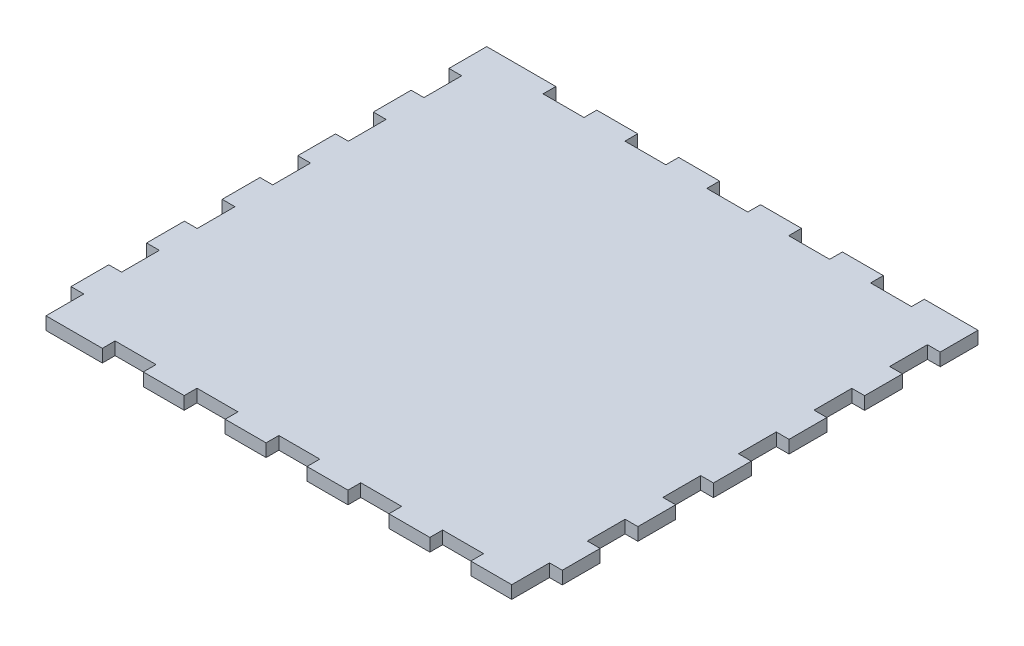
SolidWorks part; units mm, degrees
ref_plane "Front Plane" through (0, 0, 0) normal (0, 0, 1) x (1, 0, 0)
ref_plane "Top Plane" through (0, 0, 0) normal (0, 1, 0) x (1, 0, 0)
ref_plane "Right Plane" through (0, 0, 0) normal (1, 0, 0) x (0, 0, -1)
sketch "Sketch1" plane through (0, 0, 0) normal (0, 1, 0) x (1, 0, 0)
  line L1 (-65, 60) -> (65, 60)
  line L2 (-65, 60) -> (-65, -60)
  line L3 (-65, -60) -> (65, -60)
  line L4 (65, 60) -> (65, -60)
  line L5 (-65, 60) -> (65, -60) construction
  line L6 (-65, -60) -> (65, 60) construction
  point P0 (0, 0)
  dimension "D1" = 120
  dimension "D2" = 130
extrude "Boss-Extrude1" add sketch "Sketch1" along normal blind 3.38
sketch "Sketch4" plane through (0, 3.38, 0) normal (0, 1, 0) x (1, 0, 0)
  line L0 (-65, 60) -> (-65, 50)
  line L1 (-65, 60) -> (-65, -60) construction
  line L2 (-65, 50) -> (-61.62, 50)
  line L3 (-61.62, 50) -> (-61.62, 40)
  line L4 (-61.62, 40) -> (-65, 40)
  line L5 (-65, 40) -> (-65, 30)
  line L6 (-65, 30) -> (-61.62, 30)
  line L7 (-61.62, 30) -> (-61.62, 20)
  line L8 (-61.62, 20) -> (-65, 20)
  line L9 (-65, 20) -> (-65, 10)
  line L10 (-65, 10) -> (-61.62, 10)
  line L11 (-61.62, 10) -> (-61.62, 0)
  line L12 (-61.62, 0) -> (-65, 0)
  line L13 (-65, 0) -> (-65, -10)
  line L14 (-65, -10) -> (-61.62, -10)
  line L15 (-61.62, -10) -> (-61.62, -20)
  line L16 (-61.62, -20) -> (-65, -20)
  line L17 (-65, -20) -> (-65, -30)
  line L18 (-65, -30) -> (-61.62, -30)
  line L19 (-61.62, -30) -> (-61.62, -40)
  line L20 (-61.62, -40) -> (-65, -40)
  line L21 (-65, -40) -> (-65, -50)
  line L22 (-65, -50) -> (-61.62, -50)
  line L23 (-61.62, -50) -> (-61.62, -60)
  line L24 (-65, -60) -> (65, -60) construction
  line L25 (0, 60) -> (0, -60) construction
  line L26 (65, 60) -> (-65, 60) construction
  line L27 (61.62, -50) -> (61.62, -60)
  line L28 (65, -50) -> (61.62, -50)
  line L29 (65, -40) -> (65, -50)
  line L30 (61.62, -40) -> (65, -40)
  line L31 (61.62, -30) -> (61.62, -40)
  line L32 (65, -30) -> (61.62, -30)
  line L33 (65, -20) -> (65, -30)
  line L34 (61.62, -20) -> (65, -20)
  line L35 (61.62, -10) -> (61.62, -20)
  line L36 (65, -10) -> (61.62, -10)
  line L37 (65, 0) -> (65, -10)
  line L38 (61.62, 0) -> (65, 0)
  line L39 (61.62, 10) -> (61.62, 0)
  line L40 (65, 10) -> (61.62, 10)
  line L41 (65, 20) -> (65, 10)
  line L42 (61.62, 20) -> (65, 20)
  line L43 (61.62, 30) -> (61.62, 20)
  line L44 (65, 30) -> (61.62, 30)
  line L45 (65, 40) -> (65, 30)
  line L46 (61.62, 40) -> (65, 40)
  line L47 (61.62, 50) -> (61.62, 40)
  line L48 (65, 50) -> (61.62, 50)
  line L49 (65, 60) -> (65, 50)
  line L50 (-65, 60) -> (-65, -60)
  line L51 (-65, -60) -> (-61.62, -60)
  line L52 (65, 60) -> (65, -60)
  line L53 (65, -60) -> (61.62, -60)
extrude "Cut-Extrude2" cut sketch "Sketch4" against normal blind 3.38 contours L44 L43 L42 M5 | L48 L47 L46 M5 | L40 L39 L38 M5 | L36 L35 L34 M5 | L28 L27 M5 M8 | L32 L31 L30 M5 | L23 L22 M7 M8 | L20 L19 L18 M7 | L16 L15 L14 M7 | L12 L11 L10 M7 | L8 L7 L6 M7 | L4 L3 L2 M7
sketch "Sketch5" plane through (0, 3.38, 0) normal (0, 1, 0) x (1, 0, 0)
  line L0 (61.62, 0) -> (-61.62, 0) construction
  line L2 (50.7867, 60) -> (61.62, 60)
  line L3 (-61.62, -60) -> (61.62, -60) construction
  line L4 (50.7867, 56.62) -> (50.7867, 60)
  line L5 (-46.7133, -60) -> (-46.7133, -56.62)
  line L6 (-46.7133, -56.62) -> (-35.88, -56.62)
  line L7 (-35.88, -56.62) -> (-35.88, -60)
  line L8 (-35.88, -60) -> (-25.0467, -60)
  line L9 (-25.0467, -60) -> (-25.0467, -56.62)
  line L10 (-25.0467, -56.62) -> (-14.2133, -56.62)
  line L11 (-14.2133, -56.62) -> (-14.2133, -60)
  line L12 (-14.2133, -60) -> (-3.38, -60)
  line L13 (-3.38, -60) -> (-3.38, -56.62)
  line L14 (-3.38, -56.62) -> (7.4533, -56.62)
  line L15 (7.4533, -56.62) -> (7.4533, -60)
  line L16 (7.4533, -60) -> (18.2867, -60)
  line L17 (18.2867, -60) -> (18.2867, -56.62)
  line L18 (18.2867, -56.62) -> (29.12, -56.62)
  line L19 (29.12, -56.62) -> (29.12, -60)
  line L20 (29.12, -60) -> (39.9533, -60)
  line L21 (39.9533, -60) -> (39.9533, -56.62)
  line L22 (39.9533, -56.62) -> (50.7867, -56.62)
  line L23 (50.7867, -56.62) -> (50.7867, -60)
  line L24 (50.7867, -60) -> (61.62, -60)
  line L25 (39.9533, 56.62) -> (50.7867, 56.62)
  line L26 (39.9533, 60) -> (39.9533, 56.62)
  line L27 (29.12, 60) -> (39.9533, 60)
  line L28 (29.12, 56.62) -> (29.12, 60)
  line L29 (18.2867, 56.62) -> (29.12, 56.62)
  line L30 (18.2867, 60) -> (18.2867, 56.62)
  line L31 (7.4533, 60) -> (18.2867, 60)
  line L32 (7.4533, 56.62) -> (7.4533, 60)
  line L33 (-3.38, 56.62) -> (7.4533, 56.62)
  line L34 (-3.38, 60) -> (-3.38, 56.62)
  line L35 (-14.2133, 60) -> (-3.38, 60)
  line L36 (-14.2133, 56.62) -> (-14.2133, 60)
  line L37 (-25.0467, 56.62) -> (-14.2133, 56.62)
  line L38 (-25.0467, 60) -> (-25.0467, 56.62)
  line L39 (-35.88, 60) -> (-25.0467, 60)
  line L40 (-35.88, 56.62) -> (-35.88, 60)
  line L41 (-46.7133, 56.62) -> (-35.88, 56.62)
  line L42 (-46.7133, 60) -> (-46.7133, 56.62)
  line L43 (-46.7133, -60) -> (50.7867, -60)
  line L44 (-46.7133, 60) -> (50.7867, 60)
extrude "Cut-Extrude3" cut sketch "Sketch5" against normal blind 3.38 contours L44 L42 L41 L40 | L44 L38 L37 L36 | L44 L34 L33 L32 | L44 L30 L29 L28 | L44 L26 L25 L4 | L21 L43 L23 L22 | L17 L43 L19 L18 | L13 L43 L15 L14 | L9 L43 L11 L10 | L5 L43 L7 L6
equation "\"length\"= 120mm"
equation "\"D1@Sketch4\"=\"length\"/12"
equation "\"D2@Sketch4\"=\"length\"/12"
equation "\"D3@Sketch4\"=\"length\"/12"
equation "\"D4@Sketch4\"=\"length\"/12"
equation "\"D5@Sketch4\"=\"length\"/12"
equation "\"D6@Sketch4\"=\"length\"/12"
equation "\"D7@Sketch4\"=\"length\"/12"
equation "\"D8@Sketch4\"=\"length\"/12"
equation "\"D9@Sketch4\"=\"length\"/12"
equation "\"D10@Sketch4\"=\"length\"/12"
equation "\"D11@Sketch4\"=\"length\"/12"
equation "\"thickness of material\" = 3.38mm"
equation "\"D12@Sketch4\"=\"thickness of material\""
equation "\"D13@Sketch4\"=\"thickness of material\""
equation "\"D14@Sketch4\"=\"thickness of material\""
equation "\"D15@Sketch4\"=\"thickness of material\""
equation "\"D16@Sketch4\"=\"thickness of material\""
equation "\"D17@Sketch4\"=\"thickness of material\""
equation "\"width\"= 130mm"
equation "\"D1@Sketch5\"=\"width\"/12"
equation "\"D2@Sketch5\"=\"width\"/12"
equation "\"D3@Sketch5\"=\"width\"/12"
equation "\"D4@Sketch5\"=\"width\"/12"
equation "\"D5@Sketch5\"=\"width\"/12"
equation "\"D6@Sketch5\"=\"width\"/12"
equation "\"D7@Sketch5\"=\"width\"/12"
equation "\"D8@Sketch5\"=\"width\"/12"
equation "\"D9@Sketch5\"=\"width\"/12"
equation "\"D10@Sketch5\"=\"width\"/12"
equation "\"D11@Sketch5\"=\"thickness of material\""
equation "\"D12@Sketch5\"=\"thickness of material\""
equation "\"D13@Sketch5\"=\"thickness of material\""
equation "\"D14@Sketch5\"=\"thickness of material\""
equation "\"D15@Sketch5\"=\"thickness of material\""
equation "\"D1@Boss-Extrude1\"=\"thickness of material\""
equation "\"D1@Cut-Extrude2\"=\"thickness of material\""
equation "\"D1@Cut-Extrude3\"=\"thickness of material\""
